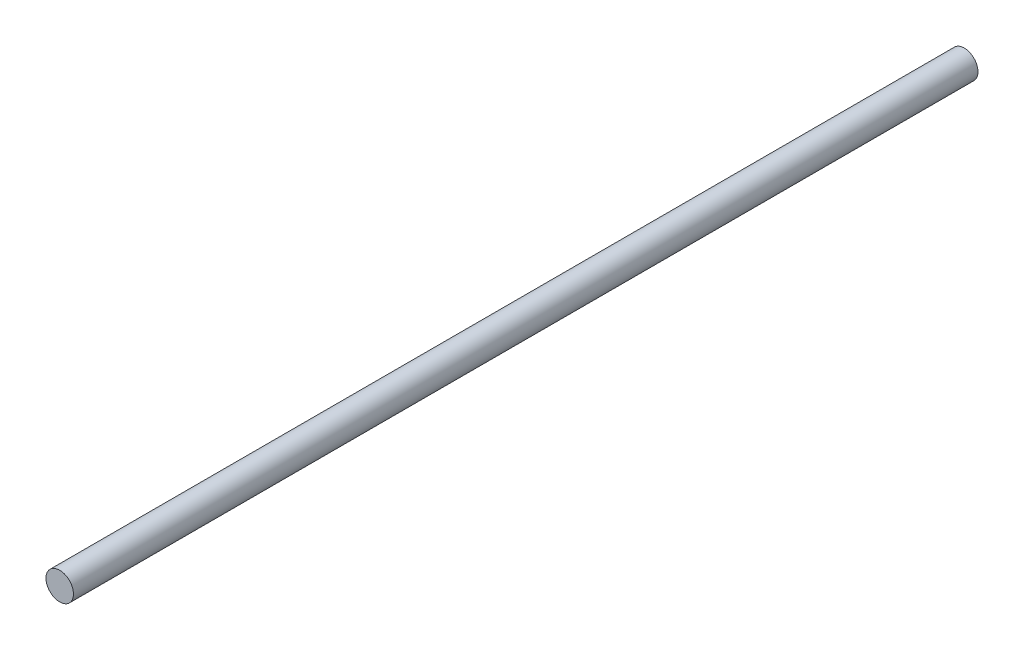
SolidWorks part; units mm, degrees
ref_plane "Спереди" through (0, 0, 0) normal (0, 0, 1) x (1, 0, 0)
ref_plane "Сверху" through (0, 0, 0) normal (0, 1, 0) x (1, 0, 0)
ref_plane "Справа" through (0, 0, 0) normal (1, 0, 0) x (0, 0, -1)
sketch "Эскиз1" plane through (0, 0, 0) normal (0, 0, 1) x (1, 0, 0)
  circle A0 centre (0, 0) radius 3.175
  dimension "D1" = 6.35
extrude "Бобышка-Вытянуть1" add sketch "Эскиз1" along normal blind 209
